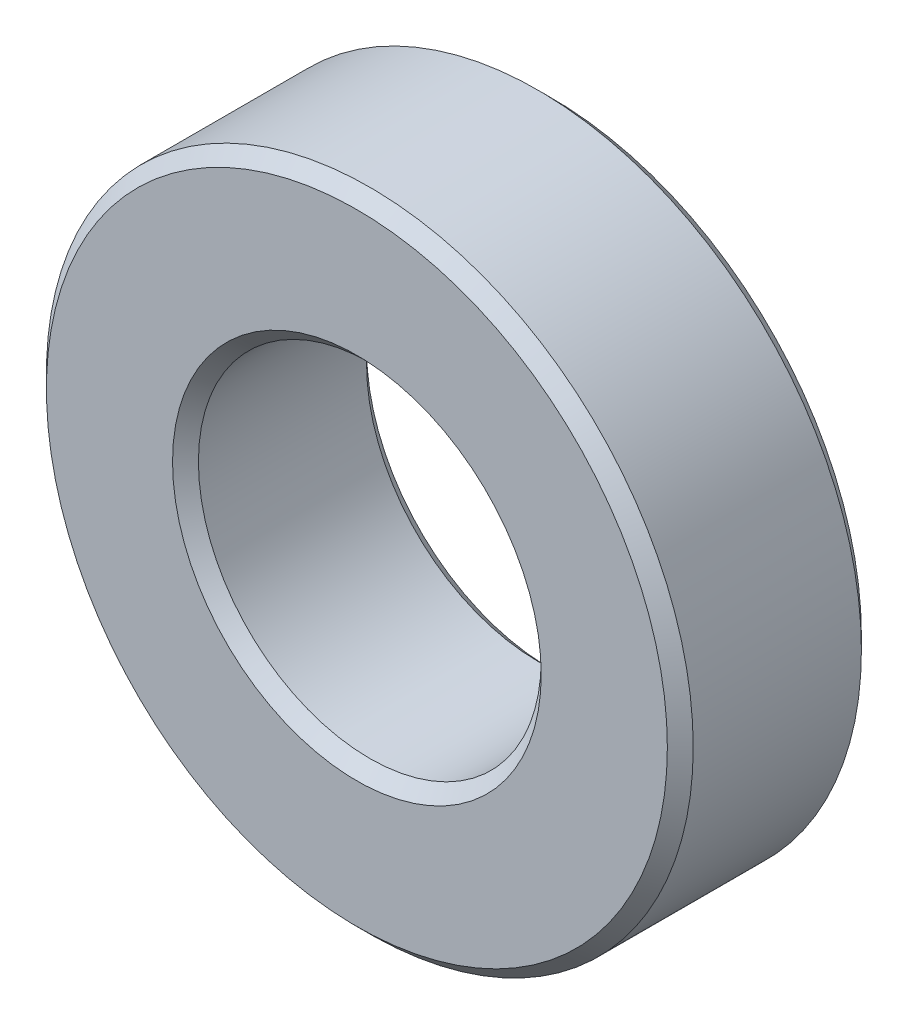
SolidWorks part; units mm, degrees
ref_plane "Front Plane" through (0, 0, 0) normal (0, 0, 1) x (1, 0, 0)
ref_plane "Top Plane" through (0, 0, 0) normal (0, 1, 0) x (1, 0, 0)
ref_plane "Right Plane" through (0, 0, 0) normal (1, 0, 0) x (0, 0, -1)
sketch "Sketch1" plane through (0, 0, 0) normal (0, 0, 1) x (1, 0, 0)
  circle A0 centre (0, 0) radius 5
  circle A1 centre (0, 0) radius 2.65
  dimension "D1" = 10
  dimension "D2" = 5.3
extrude "Boss-Extrude2" add sketch "Sketch1" along normal mid plane 3
chamfer "Chamfer3" distance 0.2 angle 45 4 edges at (5, 0, 1.5) (5, 0, -1.5) (2.65, 0, -1.5) (2.65, 0, 1.5)
